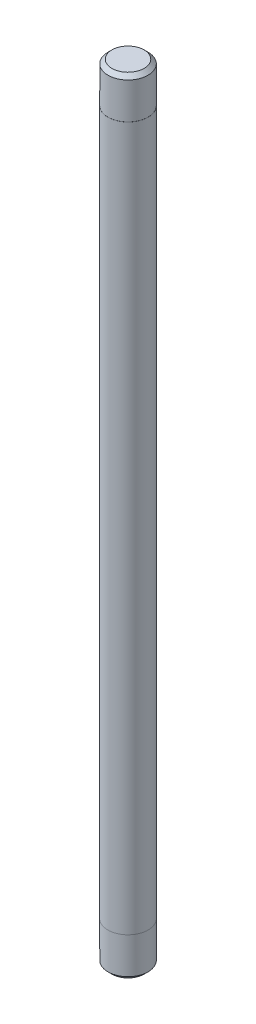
SolidWorks part; units mm, degrees
ref_plane "Front" through (0, 0, 0) normal (0, 0, 1) x (1, 0, 0)
ref_plane "Top" through (0, 0, 0) normal (0, 1, 0) x (1, 0, 0)
ref_plane "Right" through (0, 0, 0) normal (1, 0, 0) x (0, 0, -1)
sketch "Sketch1" plane through (0, 0, 0) normal (0, 1, 0) x (1, 0, 0)
  circle A0 centre (0, 0) radius 2
extrude "Extrude1" add sketch "Sketch1" along normal blind 78
chamfer "Chamfer1" distance 0.4 angle 45 1 edges at (0, 78, 2)
chamfer "Chamfer2" distance 0.4 angle 45 1 edges at (0, 0, 2)
sketch "Sketch2" plane through (0, 78, 0) normal (0, 1, 0) x (-1, 0, 0)
  circle A0 centre (0, 0) radius 2
  circle A1 centre (0, 0) radius 1.99
extrude "Cut-Extrude1" cut sketch "Sketch2" against normal blind 4
sketch "Sketch3" plane through (0, 0, 0) normal (0, -1, 0) x (1, 0, 0)
  circle A0 centre (0, 0) radius 2
  circle A1 centre (0, 0) radius 1.99
extrude "Cut-Extrude2" cut sketch "Sketch3" against normal blind 4
